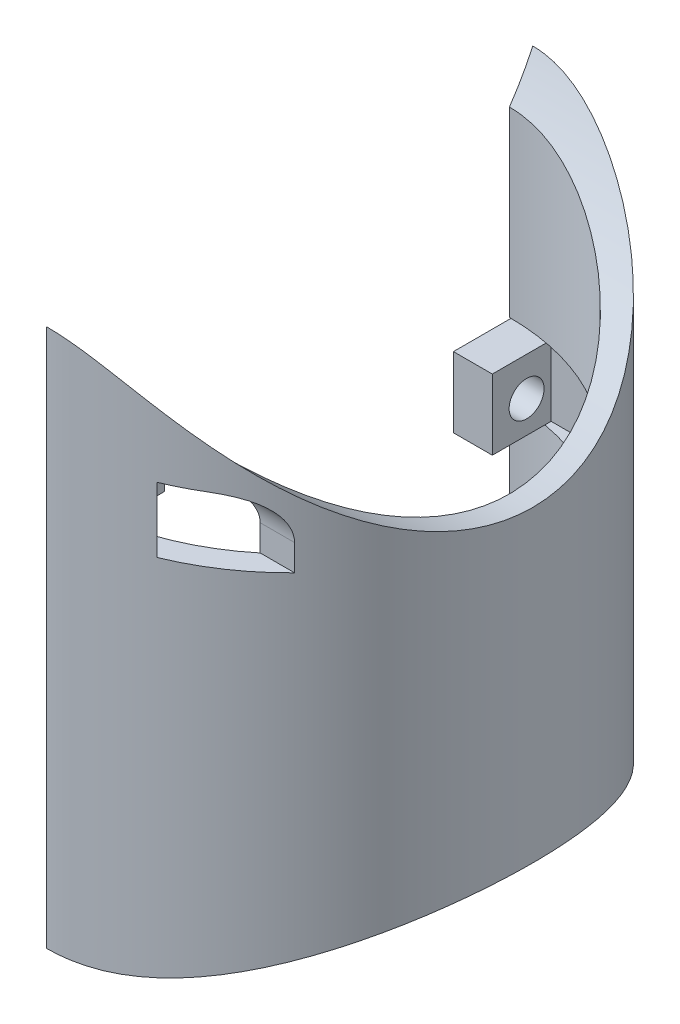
SolidWorks part; units mm, degrees
ref_plane "Front Plane" through (0, 0, 0) normal (0, 0, 1) x (1, 0, 0)
ref_plane "Top Plane" through (0, 0, 0) normal (0, 1, 0) x (1, 0, 0)
ref_plane "Right Plane" through (0, 0, 0) normal (1, 0, 0) x (0, 0, -1)
body saved out of another part "Stock-tope-1"
sketch "Sketch6" plane through (0, 0, 0) normal (1, 0, 0) x (0, 0, -1)
  line L1 (-11.5613, 59.0448) -> (-8.7115, 59.0448)
  line L2 (-11.5613, 59.0448) -> (-11.5613, 55.6975)
  line L3 (-11.5613, 55.6975) -> (-8.7115, 55.6975)
  line L4 (-8.7115, 59.0448) -> (-8.7115, 55.6975)
  line L6 (8.8189, 52.5829) -> (11.4432, 52.5829)
  line L7 (8.8189, 52.5829) -> (8.8189, 48.8839)
  line L8 (8.8189, 48.8839) -> (11.4432, 48.8839)
  line L9 (11.4432, 52.5829) -> (11.4432, 48.8839)
extrude "Cut-Extrude2" cut sketch "Sketch6" along normal through all
ref_plane "Plane1" through (0, 0, 0) normal (1, 0, 0) x (0, 0, -1)
sketch "Sketch7" plane through (0, 0, 0) normal (1, 0, 0) x (0, 0, -1)
  line L1 (-8.4469, 59.8028) -> (-11.5613, 59.8028)
  line L2 (-8.4469, 59.8028) -> (-8.4469, 55.6975)
  line L3 (-8.4469, 55.6975) -> (-11.5613, 55.6975)
  line L4 (-11.5613, 59.8028) -> (-11.5613, 55.6975)
  line L5 (11.4432, 48.8839) -> (8.4211, 48.8839)
  line L6 (11.4432, 48.8839) -> (11.4432, 52.5001)
  line L7 (11.4432, 52.5001) -> (8.4211, 52.5001)
  line L8 (8.4211, 48.8839) -> (8.4211, 52.5001)
  circle A0 centre (10.1834, 50.5237) radius 0.9
  circle A1 centre (-10.6074, 57.468) radius 0.9
  dimension "D1" = 1.8
  dimension "D2" = 1.8
extrude "Boss-Extrude1" add sketch "Sketch7" along normal blind 2
sketch "Sketch8" plane through (0, 0, 0) normal (1, 0, 0) x (0, 0, -1)
  circle A0 centre (0, 69.7503) radius 13.7308
extrude "Cut-Extrude3" cut sketch "Sketch8" along normal through all
fillet "Fillet1" radius 2 1 edges at (8.0808, 59.0448, 8.7115)
sketch "Sketch9" plane through (0, 0, 0) normal (1, 0, 0) x (0, 0, -1)
  circle A0 centre (0, 17.7519) radius 22.4369
extrude "Cut-Extrude4" cut sketch "Sketch9" along normal through all
